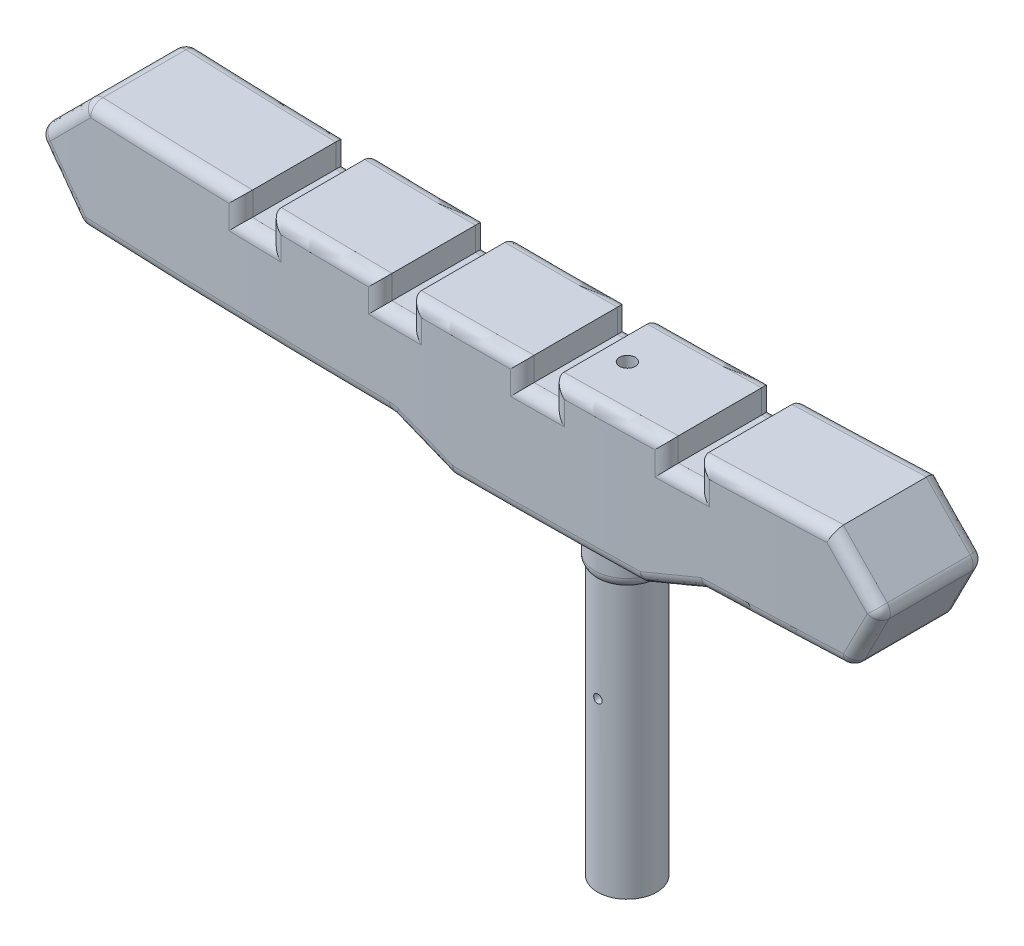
SolidWorks part; units mm, degrees
ref_plane "Plan1" through (0, 0, 0) normal (0, 0, 1) x (1, 0, 0)
ref_plane "Plan2" through (0, 0, 0) normal (0, 1, 0) x (1, 0, 0)
ref_plane "Plan3" through (0, 0, 0) normal (1, 0, 0) x (0, 0, -1)
mirrored part "patin-D-"
